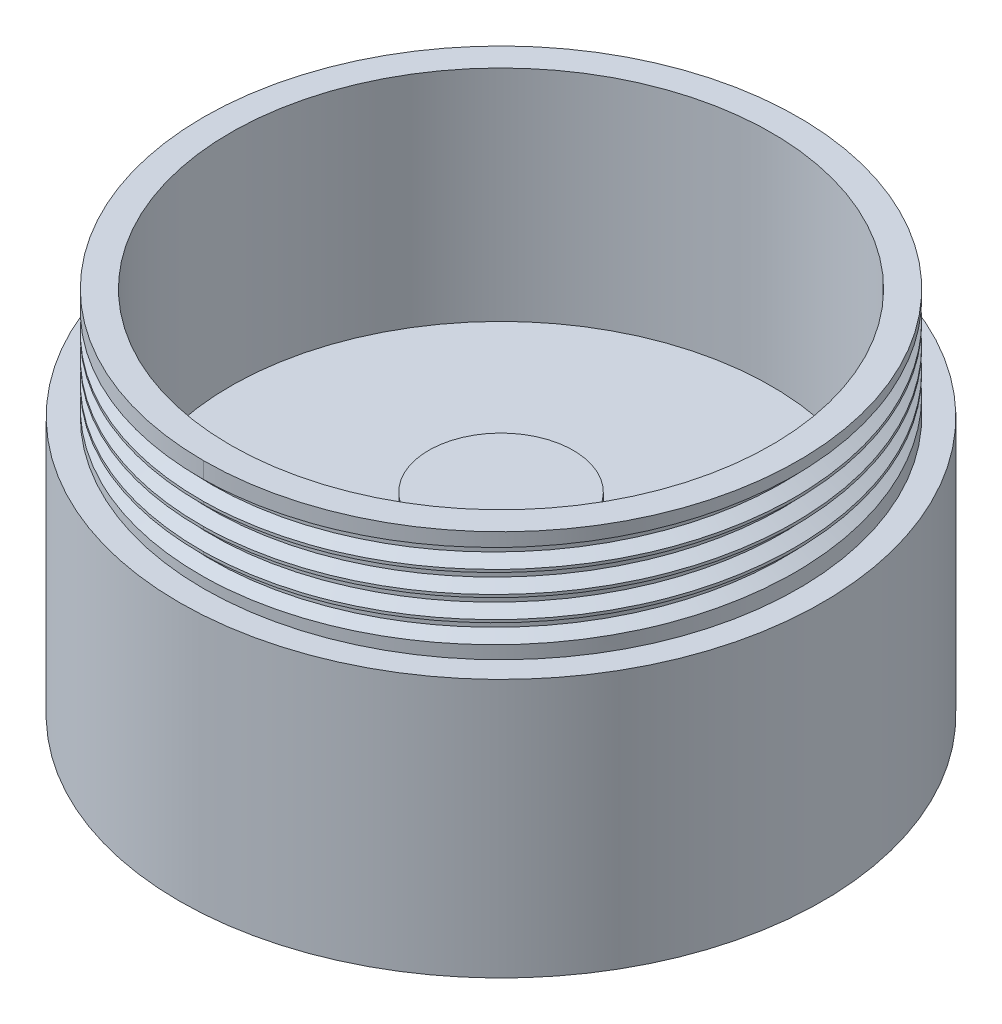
SolidWorks part; units mm, degrees
ref_plane "Frontal Plane" through (0, 0, 0) normal (0, 0, 1) x (1, 0, 0)
ref_plane "Horizontal Plane" through (0, 0, 0) normal (0, 1, 0) x (1, 0, 0)
ref_plane "Profile Plane" through (0, 0, 0) normal (1, 0, 0) x (0, 0, -1)
sketch "Sketch1" plane through (0, 0, 0) normal (0, 0, 1) x (1, 0, 0)
  line L1 (0, 5.14) -> (1.4097, 5.14)
  line L2 (1.4097, 5.14) -> (1.4097, 11.617)
  line L3 (1.4097, 11.617) -> (2.9845, 11.617)
  line L4 (2.9845, 11.617) -> (2.9845, -1.21)
  line L5 (2.9845, -1.21) -> (14.5669, -1.21)
  line L6 (14.5669, -1.21) -> (14.5669, 1.33)
  line L7 (14.5669, 1.33) -> (18.796, 1.33)
  line L8 (18.796, 1.33) -> (18.796, -9.973)
  line L9 (18.796, -9.973) -> (14.5669, -9.973)
  line L10 (14.5669, -9.973) -> (14.5669, -4.766)
  line L11 (14.5669, -4.766) -> (10.4013, -4.766)
  line L15 (1.4429, -9.973) -> (0, -9.973)
  line L17 (18.796, 12.6656) -> (18.796, -12.9393) construction
  line L18 (1.4429, -9.973) -> (1.9825, -9.7964)
  line L19 (1.9825, -9.7964) -> (10.4013, -4.766)
  line L20 (0, 5.14) -> (0, -9.973)
  point P0 (16.6815, -9.973)
  dimension "D1" = 21.59
  dimension "D2" = 18.796
  dimension "D3" = 15.8115
  dimension "D4" = 4.2291
  dimension "D5" = 1.5748
  dimension "D6" = 6.477
  dimension "D7" = 5.207
  dimension "D8" = 16.7894
  dimension "D9" = 12.827
  dimension "D10" = 10.287
  dimension "D11" = 0.5396
  dimension "D12" = 8.4188
  dimension "D13" = 5.0304
  dimension "D14" = 1.33
revolve "Revolve1" add sketch "Sketch1" angle 360 about L17
thread "Thread1" pitch 1.27 start angle 0, offset 0, length 0, pitch 1.27, diameter 34.7726
ref_plane "Plane1" through (1.4097, 11.617, 0) normal (0, 0, 1) x (-1, 0, 0)
sketch "Thread Profile1" plane through (1.4097, 11.617, 0) normal (0, 0, 1) x (-1, 0, 0)
  line L0 (0, 0) -> (0, 1.27) construction
  line L11 (0, 0) -> (0, 1.1112)
  line L12 (0, 1.1112) -> (-0.6874, 0.7144)
  line L13 (-0.6874, 0.7144) -> (-0.6874, 0.3969)
  line L15 (-0.6874, 0.3969) -> (0, 0)
  line L17 (-0.6874, 0.5556) -> (0, 0.5556) construction
  point P2 (0, 0)
  dimension "Pitch" = 1.27
  dimension "Profile_Angle" = 60
  dimension "Profile_Land" = 0.3175
  dimension "Profile_Height" = 0.6874
